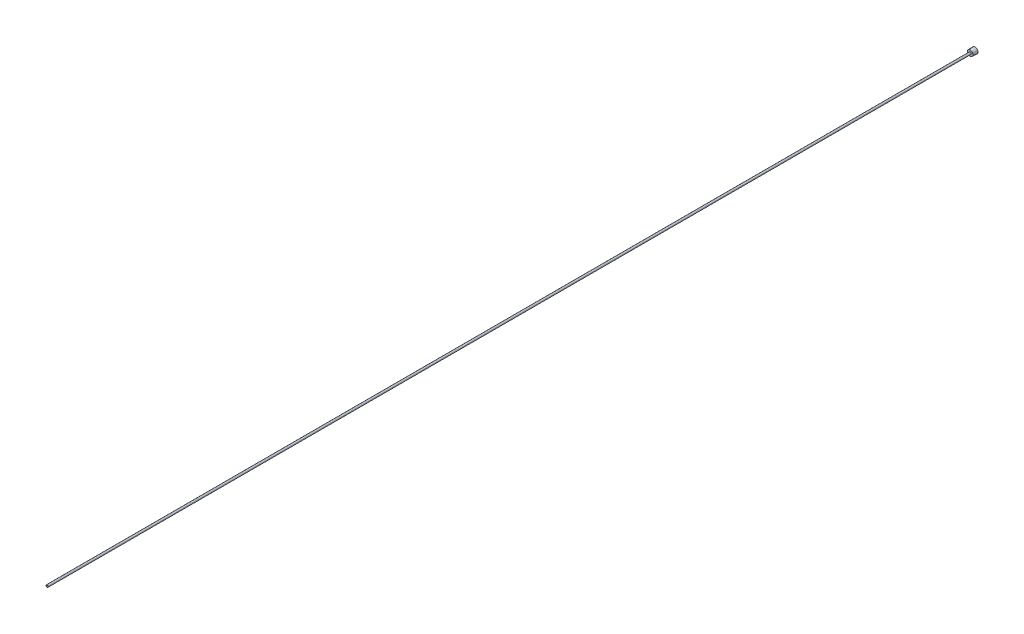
SolidWorks part; units mm, degrees
ref_plane "Front Plane" through (0, 0, 0) normal (0, 0, 1) x (1, 0, 0)
ref_plane "Top Plane" through (0, 0, 0) normal (0, 1, 0) x (1, 0, 0)
ref_plane "Right Plane" through (0, 0, 0) normal (1, 0, 0) x (0, 0, -1)
sketch "Sketch1" plane through (0, 0, 0) normal (1, 0, 0) x (0, 0, -1)
  line L0 (-1219.2, 0) -> (0, 0)
  line L5 (0, 3.8989) -> (-6.35, 3.6674)
  line L6 (0, 0) -> (0, 3.8989)
  line L7 (-6.35, 3.6674) -> (-6.35, 1.3891)
  line L8 (-6.35, 1.3891) -> (-1219.2, 1.3891)
  line L9 (-1219.2, 1.3891) -> (-1219.2, 0)
  line L10 (0, 0) -> (49989.3417, 0) construction
  dimension "D1" = 2.088
  dimension "D2" = 6.35
  dimension "D3" = 1219.2
  dimension "D4" = 2.7781
  dimension "D5" = 7.7978
revolve "Revolve1" add sketch "Sketch1" angle 360 about L10
sketch "Sketch2" plane through (0, 0, 1219.2) normal (0, 0, 1) x (1, 0, 0)
  circle A0 centre (0, 0) radius 1.2065
  dimension "D1" = 2.413
extrude "Cut-Extrude1" cut sketch "Sketch2" against normal through all
sketch "Sketch3" plane through (0, 0, 0) normal (0, 0, -1) x (-1, 0, 0)
  line L0 (0, 4.2888) -> (0, -4.2888) construction
  line L1 (0, -2.757) -> (2.3876, -1.3785)
  line L2 (2.3876, -1.3785) -> (2.3876, 1.3785)
  line L3 (2.3876, 1.3785) -> (0, 2.757)
  line L4 (0, 2.757) -> (-2.3876, 1.3785)
  line L5 (-2.3876, 1.3785) -> (-2.3876, -1.3785)
  line L6 (-2.3876, -1.3785) -> (0, -2.757)
  circle A0 centre (0, 0) radius 2.3876 construction
  dimension "D1" = 4.7752
extrude "Cut-Extrude2" cut sketch "Sketch3" against normal blind 3.9688
